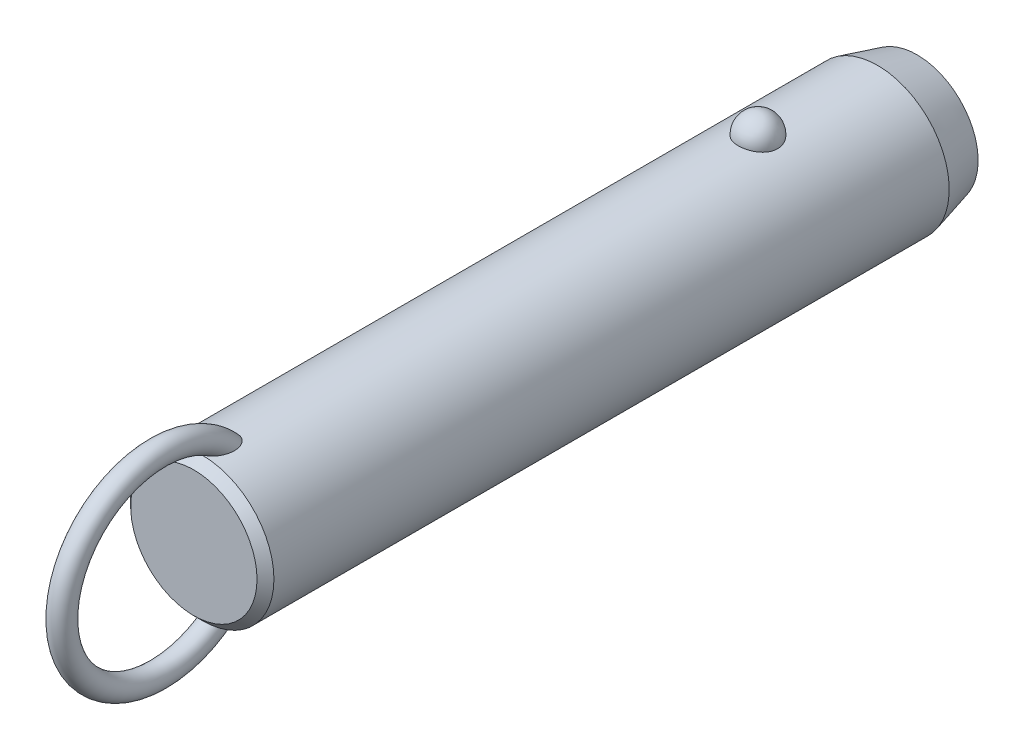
SolidWorks part; units mm, degrees
ref_plane "Front Plane" through (0, 0, 0) normal (0, 0, 1) x (1, 0, 0)
ref_plane "Top Plane" through (0, 0, 0) normal (0, 1, 0) x (1, 0, 0)
ref_plane "Right Plane" through (0, 0, 0) normal (1, 0, 0) x (0, 0, -1)
sketch "Sketch2" plane through (0, 0, 0) normal (0, 0, 1) x (1, 0, 0)
  circle A0 centre (0, 0) radius 12.7
  point P3 (0, 12.7)
  dimension "D1" = 25.4
extrude "Boss-Extrude1" add sketch "Sketch2" along normal blind 83.8
sketch "Sketch3" plane through (0, 0, 0) normal (0, 0, -1) x (-1, 0, 0)
  circle A0 centre (0, 0) radius 12.7
  dimension "D1" = 25.4
extrude "Boss-Extrude2" add sketch "Sketch3" along normal blind 31.7
chamfer "Chamfer1" distance 7 angle 15 1 edges at (-12.7, 0, -31.7)
sketch "Sketch12" plane through (0, 0, 0) normal (1, 0, 0) x (0, 0, -1)
  line L0 (-83.8, 12.7) -> (-83.8, -12.7) construction
  point P0 (-83.8, 0)
sketch "Sketch13" plane through (0, 0, 0) normal (1, 0, 0) x (0, 0, -1)
  circle A0 centre (-102.85, 0) radius 19.05
  point P2 (-83.8, 0)
  dimension "D1" = 38.1
sketch "Sketch14" plane through (0, 0, 0) normal (0, 1, 0) x (1, 0, 0)
  circle A0 centre (0, -85.8) radius 2
  point P2 (0, -83.8)
  dimension "D1" = 4
sweep "Sweep1" add profiles "Sketch14" path "Sketch13"
sketch "Sketch15" plane through (0, 0, 83.8) normal (0, 0, 1) x (1, 0, 0)
  circle A0 centre (0, 0) radius 12.7
  dimension "D1" = 25.4
extrude "Boss-Extrude3" add sketch "Sketch15" along normal blind 12.7
chamfer "Chamfer2" distance 1.5 angle 45 1 edges at (12.7, 0, 96.5)
sketch "Sketch18" plane through (0, 0, 0) normal (1, 0, 0) x (0, 0, -1)
  line L0 (24.7, 12.7) -> (-88.651, 12.7) construction
  line L1 (3.5, 16.2) -> (3.5, 9.2)
  line L2 (-88.651, -12.7) -> (24.7, -12.7) construction
  arc A0 (3.5, 16.2) -> (3.5, 9.2) centre (3.5, 12.7) ccw
  point P4 (0, 12.7)
  dimension "D1" = 28.9
revolve "Revolve1" add sketch "Sketch18" angle 360 about L1
